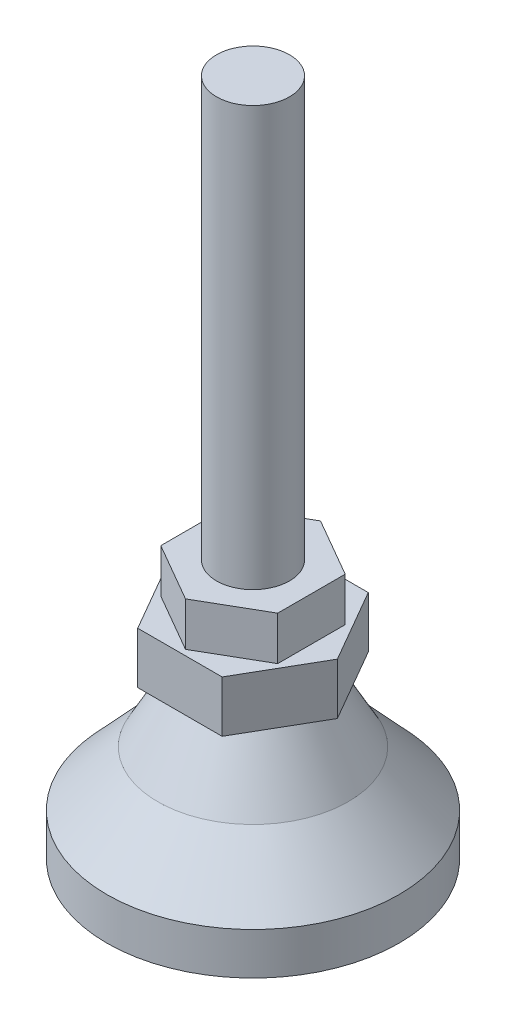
SolidWorks part; units mm, degrees
ref_plane "Front"
ref_plane "Top" through (0, 0, 0) normal (0, 1, 0) x (1, 0, 0)
ref_plane "Right" through (0, 0, 0) normal (1, 0, 0) x (0, 0, -1)
sketch "Sketch4" plane through (0, 0, 0) normal (0, 0, 1) x (1, 0, 0)
  line L0 (0, 0) -> (15.875, 0)
  line L1 (15.875, 0) -> (15.875, 4.572)
  line L2 (6.35, 17.78) -> (10.3505, 10.541)
  line L3 (6.35, 17.78) -> (0, 17.78)
  line L4 (0, 0) -> (0, 22.967) construction
  line L5 (0, 0) -> (0, 17.78)
  line L6 (10.3505, 10.541) -> (15.875, 4.572)
  dimension "D1" = 31.75
  dimension "D2" = 4.572
  dimension "D3" = 17.78
  dimension "D5" = 10.541
  dimension "D4" = 12.7
  dimension "D6" = 20.701
revolve "Revolve1" add sketch "Sketch4" angle 360 about L4
sketch "Sketch5" plane through (0, 17.78, 0) normal (0, 1, 0) x (-1, 0, 0)
  line L1 (4.5827, 7.9375) -> (-4.5827, 7.9375)
  line L2 (-4.5827, 7.9375) -> (-9.1654, 0)
  line L3 (-9.1654, 0) -> (-4.5827, -7.9375)
  line L4 (-4.5827, -7.9375) -> (4.5827, -7.9375)
  line L5 (4.5827, -7.9375) -> (9.1654, 0)
  line L6 (9.1654, 0) -> (4.5827, 7.9375)
  circle A0 centre (0, 0) radius 7.9375 construction
  dimension "D1" = 15.875
extrude "Extrude2" add sketch "Sketch5" along normal blind 5.588
sketch "Sketch7" plane through (0, 23.368, 0) normal (0, 1, 0) x (-1, 0, 0)
  line L1 (-6.35, 3.6662) -> (-6.35, -3.6662)
  line L2 (-6.35, -3.6662) -> (0, -7.3323)
  line L3 (0, -7.3323) -> (6.35, -3.6662)
  line L4 (6.35, -3.6662) -> (6.35, 3.6662)
  line L5 (6.35, 3.6662) -> (0, 7.3323)
  line L6 (0, 7.3323) -> (-6.35, 3.6662)
  circle A0 centre (0, 0) radius 6.35 construction
  dimension "D1" = 12.7
extrude "Extrude4" add sketch "Sketch7" along normal blind 4.7498
sketch "Sketch6" plane through (0, 28.1178, 0) normal (0, 1, 0) x (-1, 0, 0)
  circle A0 centre (0, 0) radius 3.9624
  dimension "D1" = 7.9248
extrude "Extrude3" add sketch "Sketch6" along normal blind 45.5422
